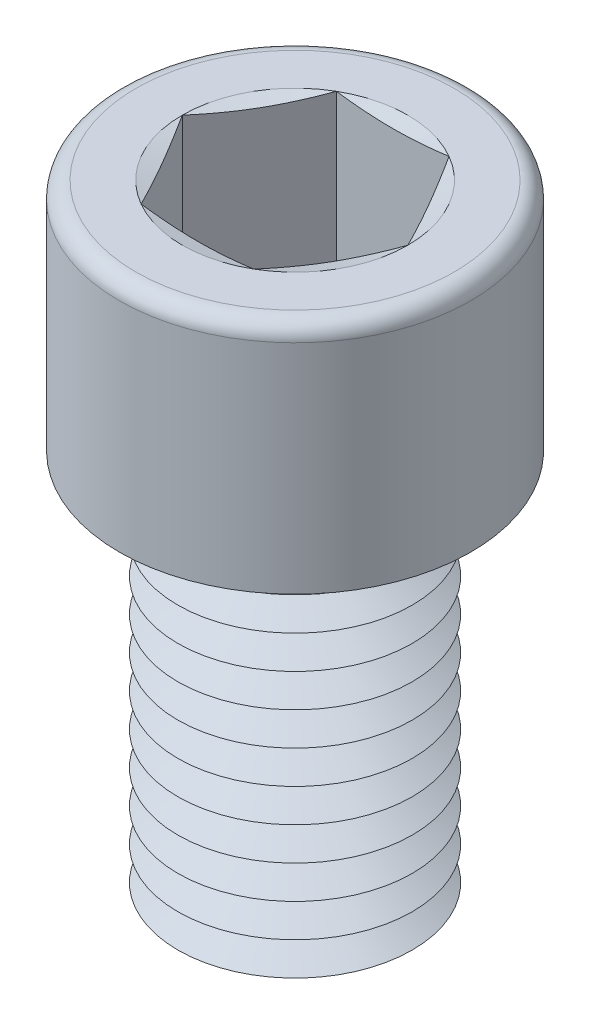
SolidWorks part; units mm, degrees
ref_plane "Front Plane" through (0, 0, 0) normal (0, 0, 1) x (1, 0, 0)
ref_plane "Top Plane" through (0, 0, 0) normal (0, 1, 0) x (1, 0, 0)
ref_plane "Right Plane" through (0, 0, 0) normal (1, 0, 0) x (0, 0, -1)
sketch "Sketch1" plane through (0, 0, 0) normal (0, 1, 0) x (1, 0, 0)
  circle A0 centre (0, 0) radius 6
  dimension "D1" = 12
extrude "Extrude1" add sketch "Sketch1" along normal blind 20
sketch "Sketch2" plane through (0, 20, 0) normal (0, 1, 0) x (1, 0, 0)
  circle A0 centre (0, 0) radius 9
  dimension "D1" = 18
extrude "Extrude2" add sketch "Sketch2" along normal blind 12
sketch "Sketch3" plane through (0, 32, 0) normal (0, 1, 0) x (1, 0, 0)
  line L1 (2.8868, 5) -> (-2.8868, 5)
  line L2 (-2.8868, 5) -> (-5.7735, 0)
  line L3 (-5.7735, 0) -> (-2.8868, -5)
  line L4 (-2.8868, -5) -> (2.8868, -5)
  line L5 (2.8868, -5) -> (5.7735, 0)
  line L6 (5.7735, 0) -> (2.8868, 5)
  circle A0 centre (0, 0) radius 5 construction
  dimension "D1" = 10
extrude "Extrude3" cut sketch "Sketch3" against normal blind 10
fillet "Fillet1" radius 0.85 1 edges at (0, 32, 9)
sketch "Sketch4" plane through (0, 0, 0) normal (1, 0, 0) x (0, 0, -1)
  line L0 (-5, 22) -> (0, 22)
  line L1 (0, 22) -> (0, 19.1132)
  line L2 (0, 19.1132) -> (-5, 22)
  dimension "D1" = 30
revolve "Cut-Revolve1" cut sketch "Sketch4" angle 360 about L1
sketch "Sketch5" plane through (0, 0, 0) normal (0, 0, 1) x (1, 0, 0)
  line L0 (-6, 0.85) -> (-6, -0.85)
  line L1 (-6, 20) -> (-6, 0) construction
  line L2 (-6, -0.85) -> (-4.5278, 0)
  line L3 (-6, 0) -> (6, 0) construction
  line L4 (-4.5278, 0) -> (-6, 0.85)
  dimension "D1" = 1.7
revolve "Cut-Revolve2" cut sketch "Sketch5" angle 360 about axis through (0, 20, 0) along (0, -1, 0)
pattern_linear "LPattern1" count 12 spacing 1.7 along (0, 1, 0) of "Cut-Revolve2"
sketch "Sketch6" plane through (0, 32, 0) normal (0, 1, 0) x (1, 0, 0)
  circle A0 centre (0, 0) radius 5.7735
extrude "Extrude4" cut sketch "Sketch6" against normal through all draft 75
